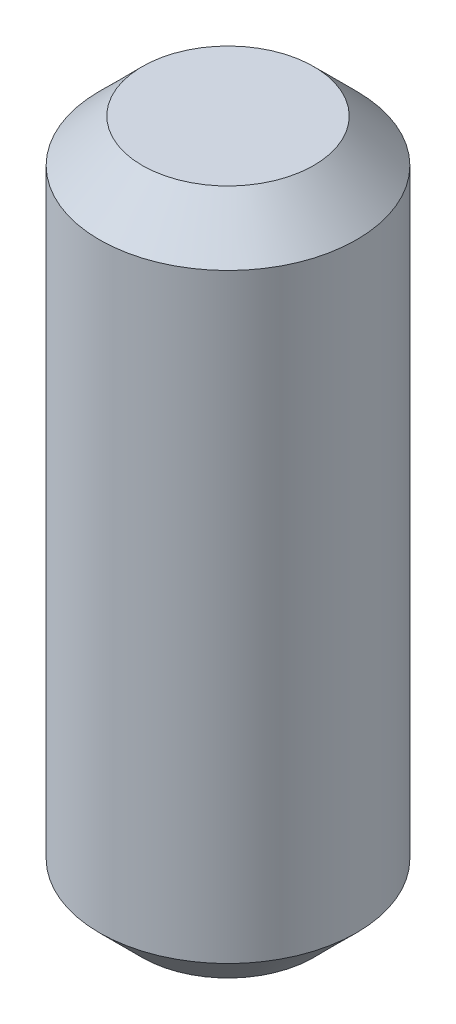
SolidWorks part; units mm, degrees
ref_plane "Ebene vorne" through (0, 0, 0) normal (0, 0, 1) x (1, 0, 0)
ref_plane "Ebene oben" through (0, 0, 0) normal (0, 1, 0) x (1, 0, 0)
ref_plane "Ebene rechts" through (0, 0, 0) normal (1, 0, 0) x (0, 0, -1)
sketch "Skizze1" plane through (0, 0, 0) normal (0, 1, 0) x (1, 0, 0)
  circle A0 centre (0, 0) radius 1.5
  dimension "D1" = 3
extrude "Aufsatz-Linear austragen1" add sketch "Skizze1" along normal blind 8
chamfer "Fase1" distance 0.5 angle 45 2 edges at (0, 8, 1.5) (0, 0, 1.5)
